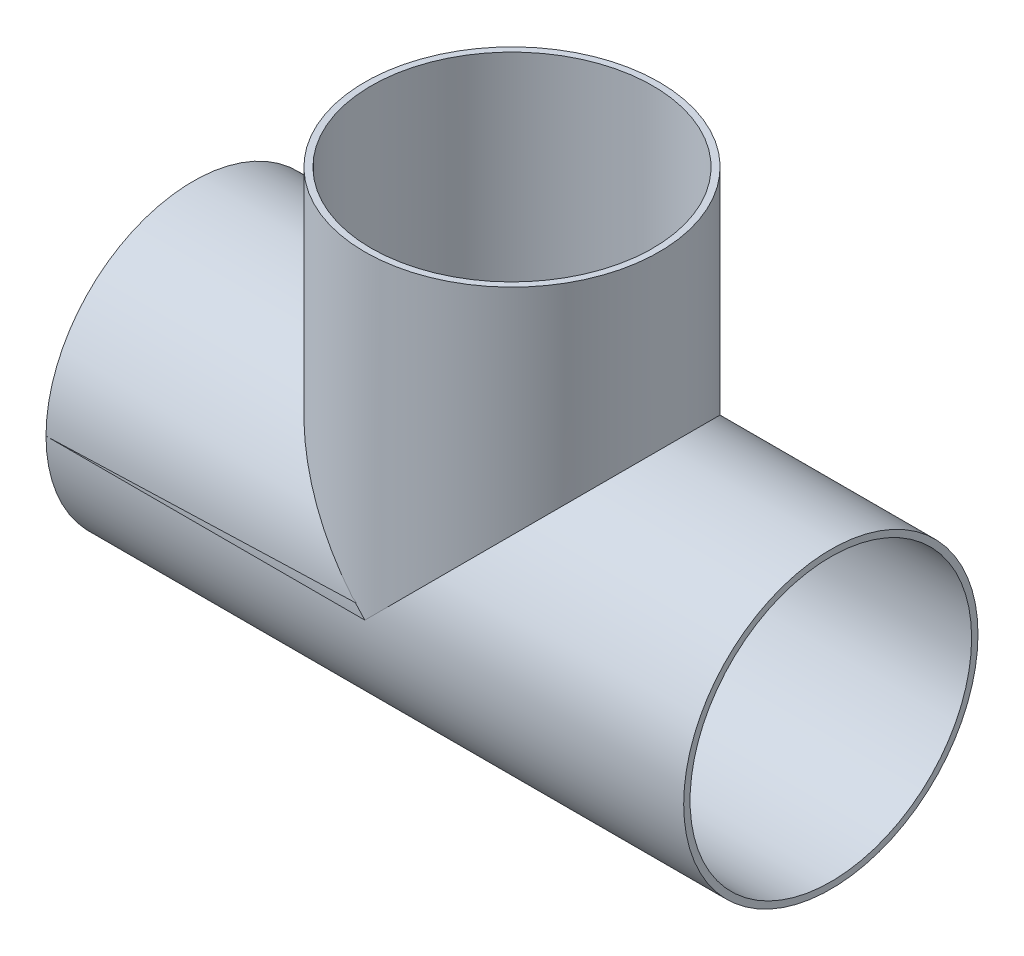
SolidWorks part; units mm, degrees
ref_plane "Front Plane" through (0, 0, 0) normal (0, 0, 1) x (1, 0, 0)
ref_plane "Top Plane" through (0, 0, 0) normal (0, 1, 0) x (1, 0, 0)
ref_plane "Right Plane" through (0, 0, 0) normal (1, 0, 0) x (0, 0, -1)
sketch "Sketch1" plane through (0, 0, 0) normal (0, 1, 0) x (1, 0, 0)
  circle A0 centre (0, 0) radius 38.1
extrude "Boss-Extrude1" add sketch "Sketch1" along normal blind 82.55
sketch "Sketch2" plane through (0, 0, 0) normal (1, 0, 0) x (0, 0, -1)
  circle A0 centre (0, 0) radius 38.1
extrude "Boss-Extrude2" add sketch "Sketch2" along normal mid plane 165.1
sketch "Sketch3" plane through (0, 82.55, 0) normal (0, 1, 0) x (1, 0, 0)
  circle A0 centre (0, 0) radius 36.449
extrude "Cut-Extrude1" cut sketch "Sketch3" against normal blind 82.55
sketch "Sketch4" plane through (82.55, 0, 0) normal (1, 0, 0) x (0, 0, -1)
  circle A0 centre (0, 0) radius 36.449
extrude "Cut-Extrude2" cut sketch "Sketch4" against normal through all
